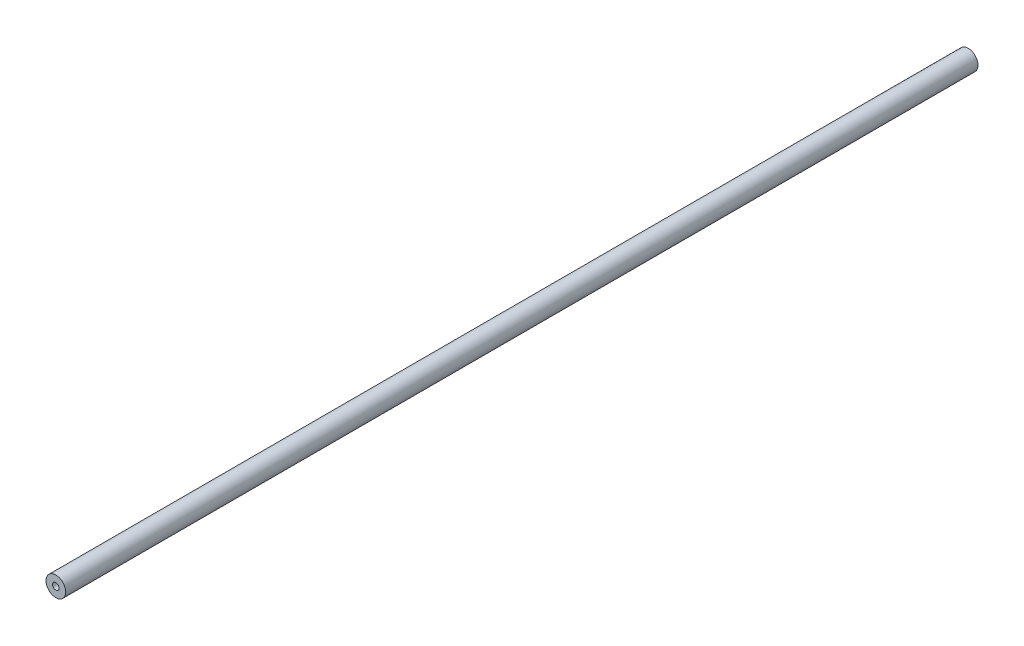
SolidWorks part; units mm, degrees
ref_plane "Plan de face" through (0, 0, 0) normal (0, 0, 1) x (1, 0, 0)
ref_plane "Plan de dessus" through (0, 0, 0) normal (0, 1, 0) x (1, 0, 0)
ref_plane "Plan de droite" through (0, 0, 0) normal (1, 0, 0) x (0, 0, -1)
sketch "Esquisse1" plane through (0, 0, 0) normal (0, 0, 1) x (1, 0, 0)
  circle A0 centre (0, 0) radius 7.5
  dimension "D1" = 15
extrude "Extrusion1" add sketch "Esquisse1" along normal mid plane 695
hole_wizard "Trou taraudé M6x1.01" positions "Esquisse3" profile "Esquisse2" tap size "M6x1.0" standard "ISO"
sketch "Esquisse3" plane through (0, 0, 347.5) normal (0, 0, 1) x (1, 0, 0)
  circle A0 centre (0, 0) radius 7.5 construction
  point P0 (0, 0)
sketch "Esquisse2" plane through (0, 0, 347.5) normal (1, 0, 0) x (0, -1, 0)
  line L0 (0, 0) -> (0, 21.5022)
  line L1 (0, 21.5022) -> (2.5, 20)
  line L2 (2.5, 20) -> (2.5, 0)
  line L5 (2.5, 0) -> (0, 0)
  line L10 (0, 21.5022) -> (-2.5, 20) construction
  line L11 (0, -6.35) -> (0, 107.95) construction
  dimension "Diamètre du trou pour taraudage" = 5
  dimension "Profondeur du trou pour taraudage" = 20
  dimension "Angle de pointe" = 118
hole_wizard "Trou taraudé M6x1.02" positions "Esquisse5" profile "Esquisse4" tap size "M6x1.0" standard "ISO"
sketch "Esquisse5" plane through (0, 0, -347.5) normal (0, 0, -1) x (-1, 0, 0)
  circle A0 centre (0, 0) radius 7.5 construction
  point P0 (0, 0)
sketch "Esquisse4" plane through (0, 0, -347.5) normal (1, 0, 0) x (0, 1, 0)
  line L0 (0, 0) -> (0, 21.5022)
  line L1 (0, 21.5022) -> (2.5, 20)
  line L2 (2.5, 20) -> (2.5, 0)
  line L5 (2.5, 0) -> (0, 0)
  line L10 (0, 21.5022) -> (-2.5, 20) construction
  line L11 (0, -6.35) -> (0, 107.95) construction
  dimension "Diamètre du trou pour taraudage" = 5
  dimension "Profondeur du trou pour taraudage" = 20
  dimension "Angle de pointe" = 118
